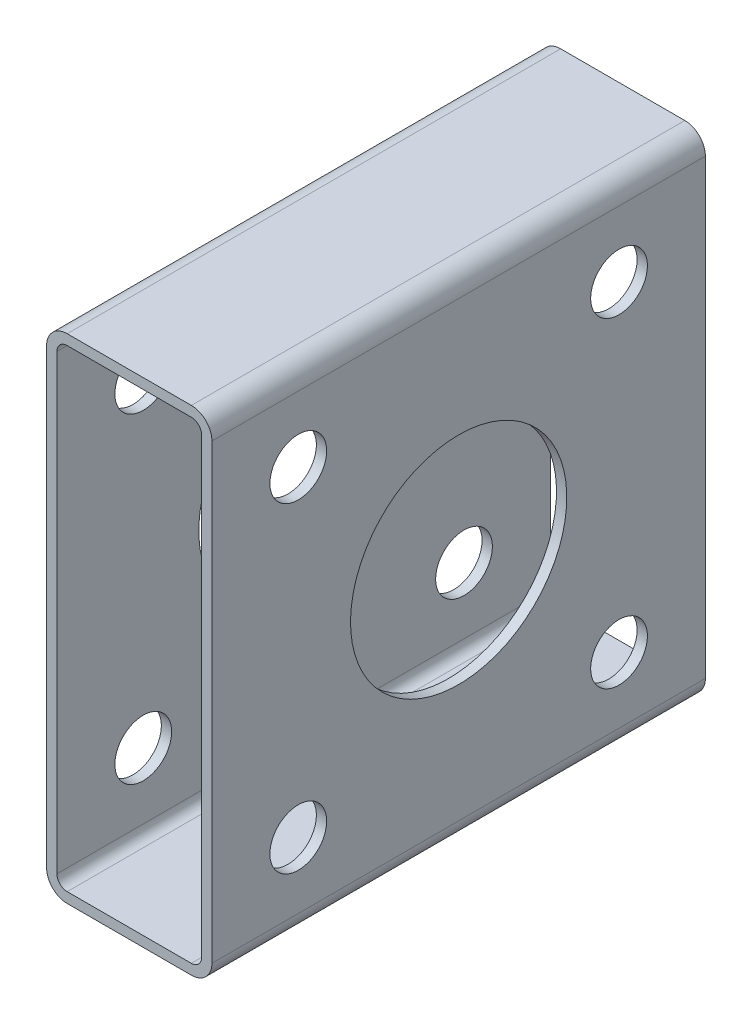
SolidWorks part; units mm, degrees
ref_plane "Plane1" through (0, 0, 0) normal (0, 0, 1) x (1, 0, 0)
ref_plane "Plane2" through (0, 0, 0) normal (0, 1, 0) x (1, 0, 0)
ref_plane "Plane3" through (0, 0, 0) normal (1, 0, 0) x (0, 0, -1)
sketch "Sketch1" plane through (0, 0, 0) normal (0, 0, 1) x (1, 0, 0)
  line L0 (-34.925, -69.85) -> (-34.925, 69.85)
  line L1 (-31.75, -76.2) -> (6.604, -76.2)
  line L2 (-38.1, -69.85) -> (-38.1, 69.85)
  line L3 (-31.75, 76.2) -> (6.604, 76.2)
  line L4 (12.954, -69.85) -> (12.954, 69.85)
  line L5 (-31.75, 73.025) -> (6.604, 73.025)
  line L6 (9.779, -69.85) -> (9.779, 69.85)
  line L7 (-31.75, -73.025) -> (6.604, -73.025)
  arc A0 (-31.75, 73.025) -> (-34.925, 69.85) centre (-31.75, 69.85) ccw
  arc A1 (9.779, 69.85) -> (6.604, 73.025) centre (6.604, 69.85) ccw
  arc A2 (9.779, -69.85) -> (6.604, -73.025) centre (6.604, -69.85) cw
  arc A3 (-34.925, -69.85) -> (-31.75, -73.025) centre (-31.75, -69.85) ccw
  arc A4 (-38.1, -69.85) -> (-31.75, -76.2) centre (-31.75, -69.85) ccw
  arc A5 (12.954, -69.85) -> (6.604, -76.2) centre (6.604, -69.85) cw
  arc A6 (12.954, 69.85) -> (6.604, 76.2) centre (6.604, 69.85) ccw
  arc A7 (-31.75, 76.2) -> (-38.1, 69.85) centre (-31.75, 69.85) ccw
  dimension "D1" = 3.175
  dimension "D2" = 6.35
  dimension "D3" = 51.054
  dimension "D4" = 152.4
extrude "CHANNEL" add sketch "Sketch1" along normal blind 152.4
sketch "Sketch2" plane through (12.954, 0, 0) normal (1, 0, 0) x (0, 0, -1)
  line L0 (-76.2, 76.2) -> (-76.2, -76.2) construction
  line L1 (-152.4, 76.2) -> (0, 76.2) construction
  line L2 (-152.4, -76.2) -> (0, -76.2) construction
  line L3 (-152.4, 0) -> (0, 0) construction
  line L4 (-152.4, -69.85) -> (-152.4, 69.85) construction
  circle A0 centre (-76.2, 0) radius 33.3953
  circle A1 centre (-125.73, 49.53) radius 8.763
  circle A2 centre (-26.67, 49.53) radius 8.763
  circle A3 centre (-26.67, -49.53) radius 8.763
  circle A4 centre (-125.73, -49.53) radius 8.763
  dimension "D1" = 49.53
  dimension "D2" = 49.53
extrude "(1) 1.375  (4) .69 HOLES " cut sketch "Sketch2" against normal up to next
sketch "Sketch4" plane through (-38.1, 0, 0) normal (-1, 0, 0) x (0, 0, 1)
  line L0 (76.2, 76.2) -> (76.2, -76.2) construction
  line L1 (152.4, 76.2) -> (0, 76.2) construction
  line L2 (152.4, -76.2) -> (0, -76.2) construction
  circle A0 centre (76.2, 0) radius 32.385
  circle A1 centre (26.67, 49.53) radius 8.763
  circle A2 centre (125.73, 49.53) radius 8.763
  circle A3 centre (26.67, -49.53) radius 8.763
  circle A4 centre (125.73, -49.53) radius 8.763
extrude "(1) 2.55  (4) .69 HOLES" cut sketch "Sketch4" against normal up to next
